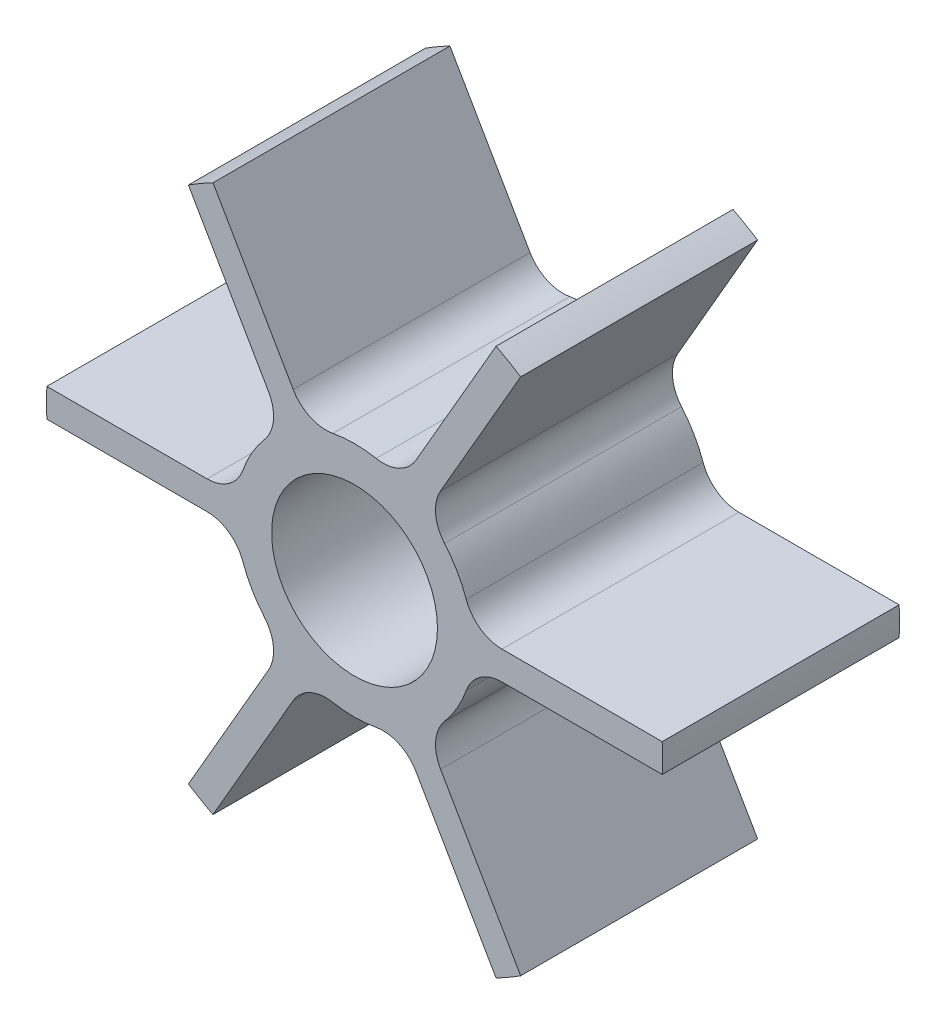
SolidWorks part; units mm, degrees
ref_plane "Front" through (0, 0, 0) normal (0, 0, 1) x (1, 0, 0)
ref_plane "Top" through (0, 0, 0) normal (0, 1, 0) x (1, 0, 0)
ref_plane "Right" through (0, 0, 0) normal (1, 0, 0) x (0, 0, -1)
sketch "Sketch1" plane through (0, 0, 0) normal (0, 0, 1) x (1, 0, 0)
  circle A0 centre (0, 0) radius 25
  dimension "D1" = 50
extrude "Extrude1" add sketch "Sketch1" along normal blind 50
sketch "Sketch3" plane through (0, 0, 50) normal (0, 0, 1) x (1, 0, 0)
  circle A0 centre (0, 0) radius 17.5
  dimension "D1" = 35
extrude "Cut-Extrude1" cut sketch "Sketch3" against normal through all
sketch "rib diameter" plane through (0, 0, 50) normal (0, 0, 1) x (1, 0, 0)
  line L0 (0, 0) -> (56.1515, 0) construction
  line L1 (24.8193, 3) -> (64.9307, 3)
  line L2 (0, -3) -> (64.9307, -3) construction
  line L3 (0, -3) -> (0, 3) construction
  line L4 (0, 3) -> (64.9307, 3) construction
  line L5 (64.9307, -3) -> (64.9307, 3) construction
  line L7 (64.9307, -3) -> (24.8193, -3)
  circle A0 centre (0, 0) radius 25 construction
  arc A1 (24.8193, -3) -> (24.8193, 3) centre (0, 0) ccw
  arc A2 (64.9307, -3) -> (64.9307, 3) centre (0, 0) ccw
  dimension "D1" = 130
  dimension "D2" = 6
extrude "rib" add sketch "rib diameter" against normal through all
fillet "Fillet1" radius 8 2 edges at (24.8193, -3, 25) (24.8193, 3, 25)
pattern_circular "CirPattern1" count 6 over 360 about axis through (0, 0, 0) along (0, 0, 1) of "rib", "Fillet1"
sketch "Sketch4" plane through (0, 0, 0) normal (0, 0, 1) x (1, 0, 0)
  line L0 (0, 0) -> (0, 70)
  line L1 (0, 0) -> (60.6218, 35)
  circle A0 centre (0, 0) radius 70 construction
  dimension "D2" = 140
  dimension "D1" = 60
extrude "Cut-Extrude2" [suppressed] cut sketch "Sketch4" along normal through all and the other way through all flip side to cut
